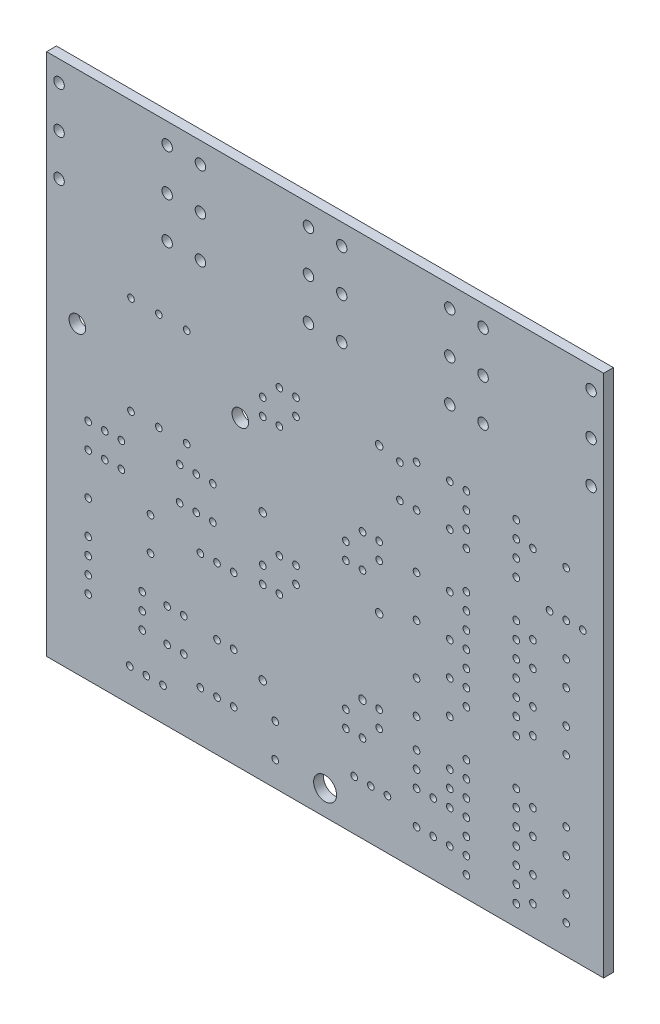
SolidWorks part; units mm, degrees
ref_plane "Front Plane" through (0, 0, 0) normal (0, 0, 1) x (1, 0, 0)
ref_plane "Top Plane" through (0, 0, 0) normal (0, 1, 0) x (1, 0, 0)
ref_plane "Right Plane" through (0, 0, 0) normal (1, 0, 0) x (0, 0, -1)
sketch "Sketch1" plane through (0, 0, 0) normal (0, 0, 1) x (1, 0, 0)
  line L1 (0, 0) -> (85.09, 0)
  line L2 (0, 0) -> (0, -80.01)
  line L3 (0, -80.01) -> (85.09, -80.01)
  line L4 (85.09, 0) -> (85.09, -80.01)
  circle A0 centre (50.8, -64.135) radius 0.508
  circle A1 centre (45.72, -66.675) radius 0.508
  circle A2 centre (12.8905, -26.162) radius 0.508
  circle A3 centre (17.145, -26.162) radius 0.508
  circle A4 centre (48.26, -66.675) radius 0.508
  circle A5 centre (12.7, -74.93) radius 0.508
  circle A6 centre (17.78, -74.93) radius 0.508
  circle A7 centre (15.24, -74.93) radius 0.508
  circle A8 centre (1.905, -3.175) radius 0.8001
  circle A9 centre (1.905, -9.525) radius 0.8001
  circle A10 centre (1.905, -15.875) radius 0.8001
  circle A11 centre (18.415, -3.175) radius 0.8001
  circle A12 centre (18.415, -15.875) radius 0.8001
  circle A13 centre (23.495, -3.175) radius 0.8001
  circle A14 centre (18.415, -9.525) radius 0.8001
  circle A15 centre (23.495, -9.525) radius 0.8001
  circle A16 centre (23.495, -15.875) radius 0.8001
  circle A17 centre (40.005, -3.175) radius 0.8001
  circle A18 centre (40.005, -9.525) radius 0.8001
  circle A19 centre (40.005, -15.875) radius 0.8001
  circle A20 centre (21.3995, -26.162) radius 0.508
  circle A21 centre (17.145, -41.148) radius 0.508
  circle A22 centre (4.699, -33.655) radius 1.27
  circle A23 centre (35.56, -26.67) radius 0.508
  circle A24 centre (48.26, -61.595) radius 0.5715
  circle A25 centre (33.02, -29.21) radius 0.508
  circle A26 centre (33.02, -31.75) radius 0.508
  circle A27 centre (50.8, -39.37) radius 0.508
  circle A28 centre (45.72, -41.91) radius 0.508
  circle A29 centre (45.72, -44.45) radius 0.508
  circle A30 centre (50.8, -48.895) radius 0.5715
  circle A31 centre (12.8905, -41.148) radius 0.508
  circle A32 centre (21.3995, -41.148) radius 0.508
  circle A33 centre (29.591, -33.655) radius 1.27
  circle A34 centre (33.02, -44.45) radius 0.5715
  circle A35 centre (38.1, -26.67) radius 0.508
  circle A36 centre (38.1, -29.21) radius 0.508
  circle A37 centre (35.56, -31.75) radius 0.508
  circle A38 centre (48.26, -39.37) radius 0.508
  circle A39 centre (50.8, -41.91) radius 0.508
  circle A40 centre (48.26, -44.45) radius 0.508
  circle A41 centre (33.02, -66.675) radius 0.5715
  circle A42 centre (35.56, -48.895) radius 0.508
  circle A43 centre (38.1, -48.895) radius 0.508
  circle A44 centre (33.02, -51.435) radius 0.508
  circle A45 centre (38.1, -51.435) radius 0.508
  circle A46 centre (33.02, -53.975) radius 0.508
  circle A47 centre (35.56, -53.975) radius 0.508
  circle A48 centre (50.8, -61.595) radius 0.508
  circle A49 centre (45.72, -64.135) radius 0.508
  circle A50 centre (50.8, -26.67) radius 0.5715
  circle A51 centre (23.495, -72.39) radius 0.508
  circle A52 centre (26.035, -72.39) radius 0.508
  circle A53 centre (28.575, -72.39) radius 0.508
  circle A54 centre (34.925, -71.12) radius 0.508
  circle A55 centre (34.925, -76.2) radius 0.508
  circle A56 centre (42.545, -76.2) radius 1.7526
  circle A57 centre (46.99, -72.39) radius 0.508
  circle A58 centre (49.53, -72.39) radius 0.508
  circle A59 centre (52.07, -72.39) radius 0.508
  circle A60 centre (76.835, -35.56) radius 0.508
  circle A61 centre (79.375, -35.56) radius 0.508
  circle A62 centre (81.915, -35.56) radius 0.508
  circle A63 centre (45.085, -3.175) radius 0.8001
  circle A64 centre (45.085, -9.525) radius 0.8001
  circle A65 centre (45.085, -15.875) radius 0.8001
  circle A66 centre (61.595, -3.175) radius 0.8001
  circle A67 centre (61.595, -9.525) radius 0.8001
  circle A68 centre (61.595, -15.875) radius 0.8001
  circle A69 centre (66.675, -3.175) radius 0.8001
  circle A70 centre (66.675, -9.525) radius 0.8001
  circle A71 centre (66.675, -15.875) radius 0.8001
  circle A72 centre (83.185, -3.175) radius 0.8001
  circle A73 centre (83.185, -9.525) radius 0.8001
  circle A74 centre (83.185, -15.875) radius 0.8001
  circle A75 centre (6.35, -45.72) radius 0.508
  circle A76 centre (8.89, -45.72) radius 0.508
  circle A77 centre (11.43, -45.72) radius 0.508
  circle A78 centre (6.35, -49.53) radius 0.508
  circle A79 centre (8.89, -49.53) radius 0.508
  circle A80 centre (11.43, -49.53) radius 0.508
  circle A81 centre (20.32, -44.45) radius 0.508
  circle A82 centre (22.86, -44.45) radius 0.508
  circle A83 centre (25.4, -44.45) radius 0.508
  circle A84 centre (20.32, -49.53) radius 0.508
  circle A85 centre (22.86, -49.53) radius 0.508
  circle A86 centre (25.4, -49.53) radius 0.508
  circle A87 centre (23.495, -54.61) radius 0.508
  circle A88 centre (26.035, -54.61) radius 0.508
  circle A89 centre (28.575, -54.61) radius 0.508
  circle A90 centre (6.35, -55.88) radius 0.508
  circle A91 centre (6.35, -60.96) radius 0.508
  circle A92 centre (15.875, -53.34) radius 0.508
  circle A93 centre (15.875, -58.42) radius 0.508
  circle A94 centre (6.35, -63.5) radius 0.508
  circle A95 centre (6.35, -66.04) radius 0.508
  circle A96 centre (6.35, -68.58) radius 0.508
  circle A97 centre (14.605, -64.135) radius 0.508
  circle A98 centre (14.605, -66.675) radius 0.508
  circle A99 centre (14.605, -69.215) radius 0.508
  circle A100 centre (18.415, -64.135) radius 0.508
  circle A101 centre (18.415, -69.215) radius 0.508
  circle A102 centre (20.955, -64.135) radius 0.508
  circle A103 centre (20.955, -69.215) radius 0.508
  circle A104 centre (26.035, -64.77) radius 0.508
  circle A105 centre (28.575, -64.77) radius 0.508
  circle A106 centre (53.975, -27.305) radius 0.508
  circle A107 centre (53.975, -32.385) radius 0.508
  circle A108 centre (56.515, -26.035) radius 0.508
  circle A109 centre (61.595, -26.035) radius 0.508
  circle A110 centre (56.515, -32.385) radius 0.508
  circle A111 centre (61.595, -32.385) radius 0.508
  circle A112 centre (64.135, -26.035) radius 0.508
  circle A113 centre (64.135, -28.575) radius 0.508
  circle A114 centre (64.135, -31.115) radius 0.508
  circle A115 centre (64.135, -33.655) radius 0.508
  circle A116 centre (71.755, -26.035) radius 0.508
  circle A117 centre (71.755, -28.575) radius 0.508
  circle A118 centre (71.755, -31.115) radius 0.508
  circle A119 centre (71.755, -33.655) radius 0.508
  circle A120 centre (74.295, -28.575) radius 0.508
  circle A121 centre (79.375, -28.575) radius 0.508
  circle A122 centre (64.135, -39.37) radius 0.508
  circle A123 centre (64.135, -41.91) radius 0.508
  circle A124 centre (64.135, -44.45) radius 0.508
  circle A125 centre (64.135, -46.99) radius 0.508
  circle A126 centre (64.135, -49.53) radius 0.508
  circle A127 centre (64.135, -52.07) radius 0.508
  circle A128 centre (64.135, -54.61) radius 0.508
  circle A129 centre (71.755, -39.37) radius 0.508
  circle A130 centre (71.755, -41.91) radius 0.508
  circle A131 centre (71.755, -44.45) radius 0.508
  circle A132 centre (71.755, -46.99) radius 0.508
  circle A133 centre (71.755, -49.53) radius 0.508
  circle A134 centre (71.755, -52.07) radius 0.508
  circle A135 centre (71.755, -54.61) radius 0.508
  circle A136 centre (56.515, -40.64) radius 0.508
  circle A137 centre (61.595, -40.64) radius 0.508
  circle A138 centre (56.515, -46.99) radius 0.508
  circle A139 centre (61.595, -46.99) radius 0.508
  circle A140 centre (74.295, -40.64) radius 0.508
  circle A141 centre (79.375, -40.64) radius 0.508
  circle A142 centre (74.295, -44.45) radius 0.508
  circle A143 centre (79.375, -44.45) radius 0.508
  circle A144 centre (74.295, -49.53) radius 0.508
  circle A145 centre (79.375, -49.53) radius 0.508
  circle A146 centre (74.295, -53.34) radius 0.508
  circle A147 centre (79.375, -53.34) radius 0.508
  circle A148 centre (61.595, -52.07) radius 0.508
  circle A149 centre (61.595, -57.15) radius 0.508
  circle A150 centre (56.515, -54.61) radius 0.508
  circle A151 centre (56.515, -59.69) radius 0.508
  circle A152 centre (64.135, -61.595) radius 0.508
  circle A153 centre (64.135, -64.135) radius 0.508
  circle A154 centre (64.135, -66.675) radius 0.508
  circle A155 centre (64.135, -69.215) radius 0.508
  circle A156 centre (64.135, -71.755) radius 0.508
  circle A157 centre (64.135, -74.295) radius 0.508
  circle A158 centre (64.135, -76.835) radius 0.508
  circle A159 centre (71.755, -61.595) radius 0.508
  circle A160 centre (71.755, -64.135) radius 0.508
  circle A161 centre (71.755, -66.675) radius 0.508
  circle A162 centre (71.755, -69.215) radius 0.508
  circle A163 centre (71.755, -71.755) radius 0.508
  circle A164 centre (71.755, -74.295) radius 0.508
  circle A165 centre (71.755, -76.835) radius 0.508
  circle A166 centre (61.595, -64.135) radius 0.508
  circle A167 centre (56.515, -64.135) radius 0.508
  circle A168 centre (61.595, -66.675) radius 0.508
  circle A169 centre (56.515, -66.675) radius 0.508
  circle A170 centre (61.595, -69.215) radius 0.508
  circle A171 centre (59.055, -69.215) radius 0.508
  circle A172 centre (56.515, -69.215) radius 0.508
  circle A173 centre (61.595, -74.295) radius 0.508
  circle A174 centre (59.055, -74.295) radius 0.508
  circle A175 centre (56.515, -74.295) radius 0.508
  circle A176 centre (74.295, -62.865) radius 0.508
  circle A177 centre (74.295, -66.675) radius 0.508
  circle A178 centre (79.375, -62.865) radius 0.508
  circle A179 centre (79.375, -66.675) radius 0.508
  circle A180 centre (74.295, -71.755) radius 0.508
  circle A181 centre (79.375, -71.755) radius 0.508
  circle A182 centre (74.295, -75.565) radius 0.508
  circle A183 centre (79.375, -75.565) radius 0.508
sheet metal parameters "Sheet-Metal1" thickness 1.4986 parameters "D1"=0.7366
base flange "Base-Flange1" sketch "Sketch1" thickness 1.4986 reverse thickness direction no parameters "D1"=0.7366
flat pattern "Flat-Pattern1"
sketch "Bend-Lines1" plane through (0, 0, 0) normal (0, 1, 0) x (-1, 0, 0)
